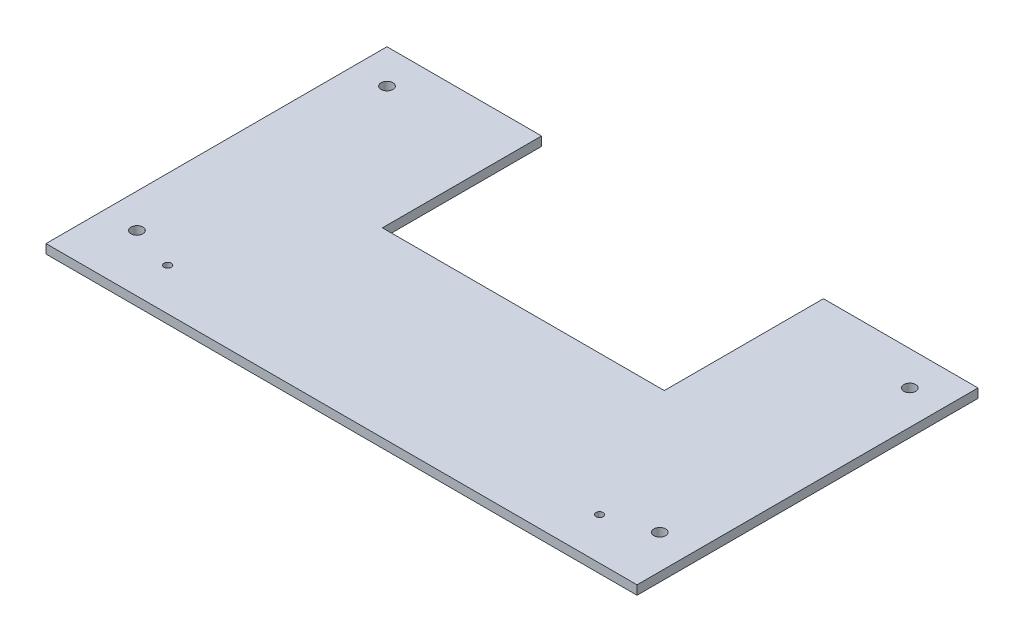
SolidWorks part; units mm, degrees
ref_plane "Alzado" through (0, 0, 0) normal (0, 0, 1) x (1, 0, 0)
ref_plane "Planta" through (0, 0, 0) normal (0, 1, 0) x (1, 0, 0)
ref_plane "Vista lateral" through (0, 0, 0) normal (1, 0, 0) x (0, 0, -1)
sketch "Croquis1" plane through (0, 0, 0) normal (0, 1, 0) x (1, 0, 0)
  line L1 (-130, -75) -> (130, -75)
  line L2 (-130, -75) -> (-130, 75)
  line L3 (-130, 75) -> (130, 75)
  line L4 (130, -75) -> (130, 75)
  line L5 (-130, -75) -> (130, 75) construction
  line L6 (-130, 75) -> (130, -75) construction
  point P0 (0, 0)
  dimension "D1" = 260
  dimension "D2" = 150
extrude "Saliente-Extruir1" add sketch "Croquis1" along normal blind 4
sketch "Croquis2" plane through (0, 4, 0) normal (0, 1, 0) x (1, 0, 0)
  line L0 (130, 75) -> (-130, 75) construction
  line L1 (-62, 5) -> (62, 5)
  line L2 (-62, 5) -> (-62, 75)
  line L3 (-62, 75) -> (62, 75)
  line L4 (62, 5) -> (62, 75)
  line L5 (-130, 75) -> (-130, -75) construction
  circle A0 centre (-115, 60) radius 2.6
  circle A1 centre (115, 60) radius 2.6
  circle A2 centre (115, -50) radius 2.6
  circle A3 centre (-115, -50) radius 2.6
  dimension "D4" = 5.2
  dimension "D5" = 15
  dimension "D1" = 62
  dimension "D2" = 62
  dimension "D3" = 70
  dimension "D6" = 15
  dimension "D7" = 2
  dimension "D8" = 2
extrude "Cortar-Extruir1" cut sketch "Croquis2" against normal blind 4
sketch "Croquis3" plane through (0, 4, 0) normal (0, 1, 0) x (1, 0, 0)
  line L7 (130, -75) -> (130, 75) construction
  line L8 (-130, -75) -> (130, -75) construction
  circle A0 centre (95, -56.5) radius 1.6
  circle A1 centre (-95, -56.5) radius 1.6
  dimension "D4" = 3.2
  dimension "D1" = 35
  dimension "D2" = 18.5
  dimension "D8" = 190
  dimension "D7" = 2
extrude "Cortar-Extruir2" cut sketch "Croquis3" against normal blind 10
